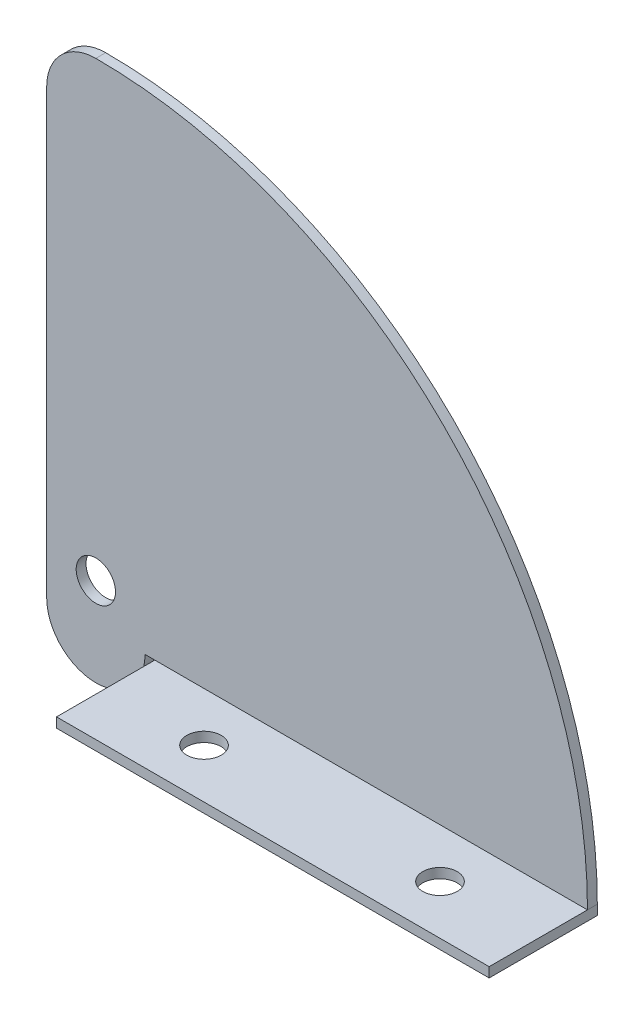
SolidWorks part; units mm, degrees
ref_plane "Front" through (0, 0, 0) normal (0, 0, 1) x (1, 0, 0)
ref_plane "Top" through (0, 0, 0) normal (0, 1, 0) x (1, 0, 0)
ref_plane "Right" through (0, 0, 0) normal (1, 0, 0) x (0, 0, -1)
sketch "Sketch1" plane through (0, 0, 0) normal (0, 0, 1) x (1, 0, 0)
  line L0 (5, 0) -> (50, 0)
  line L8 (-5, 0) -> (-5, 45)
  arc A0 (50, 0) -> (0, 50) centre (0, 0) ccw
  arc A2 (-5, 0) -> (5, 0) centre (0, 0) ccw
  arc A3 (0, 50) -> (-5, 45) centre (0, 45) ccw
  circle A4 centre (0, 4) radius 2
extrude "Extrude1" add sketch "Sketch1" along normal blind 1
sketch "Sketch5" plane through (0, 0, 0) normal (0, -1, 0) x (1, 0, 0)
  line L1 (50, 0) -> (6, 0)
  line L2 (50, 0) -> (50, 11)
  line L3 (50, 11) -> (6, 11)
  line L4 (6, 0) -> (6, 11)
  circle A0 centre (40, 6) radius 1.75
  circle A1 centre (16, 6) radius 1.75
extrude "Extrude2" add sketch "Sketch5" along normal blind 1
